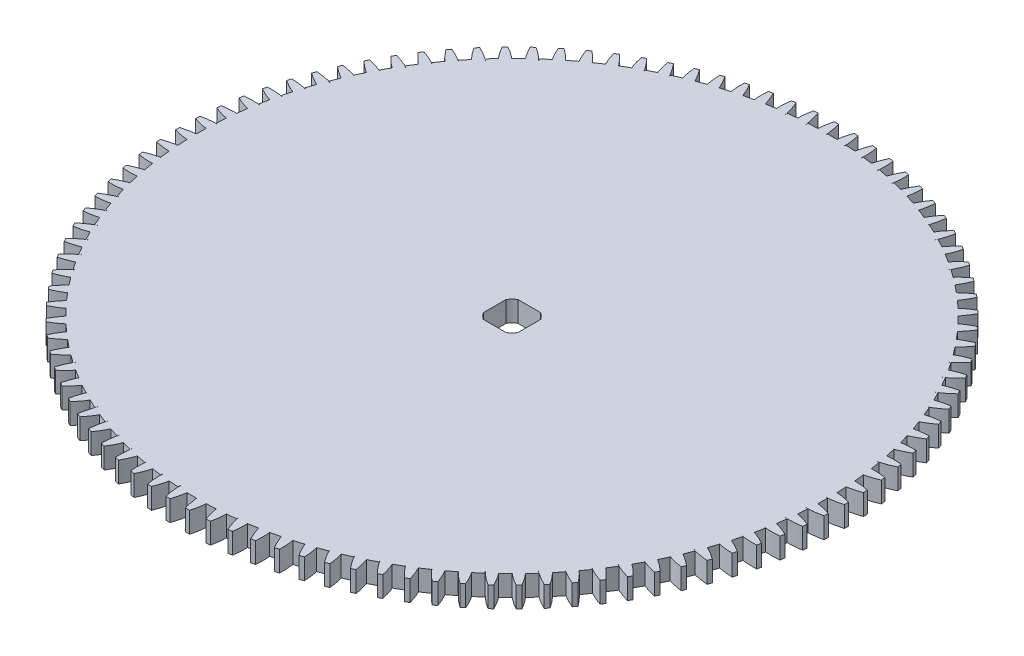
SolidWorks part; units mm, degrees
ref_plane "Front Plane" through (0, 0, 0) normal (0, 0, 1) x (1, 0, 0)
ref_plane "Top Plane" through (0, 0, 0) normal (0, 1, 0) x (1, 0, 0)
ref_plane "Right Plane" through (0, 0, 0) normal (1, 0, 0) x (0, 0, -1)
sketch "Sketch1" plane through (0, 0, 0) normal (0, 1, 0) x (1, 0, 0)
  line L0 (0, 0) -> (0, 22.6547) construction
  line L1 (0, 0) -> (-22.6547, 0) construction
  line L2 (0, 0) -> (-23.8473, -0.3602) construction
  line L3 (0, 0) -> (-22.6443, -0.6842) construction
  line L4 (0, 0) -> (-22.6133, -1.3679) construction
  circle A0 centre (0, 0) radius 23.4 construction
  circle A1 centre (0, 0) radius 22.6547 construction
  circle A2 centre (0, 0) radius 22.8375 construction
  circle A3 centre (0, 0) radius 23.85 construction
  spline S0 degree 4 poles (-22.6547, 0) (-22.7006, 0) (-22.8293, -0.0047) (-23.0718, -0.0323) (-23.4636, -0.1036) (-23.9555, -0.2325) (-24.5794, -0.4424) (-25.296, -0.7438) (-26.0604, -1.1307) (-26.8632, -1.6092) (-27.6357, -2.1365) (-28.3774, -2.7063) (-29.0885, -3.3137) (-29.9145, -4.0918) (-30.8542, -5.0873) (-31.8725, -6.3258) (-32.9282, -7.8293) (-33.8904, -9.4342) (-34.7418, -11.1002) (-35.3924, -12.6024) (-35.8843, -13.916) (-36.2511, -15.0257) (-36.5191, -15.9214) (-36.8226, -17.05) (-37.0847, -18.189) (-37.3062, -19.3369) (-37.5244, -20.7218) (-37.6528, -21.7666) (-37.7399, -22.6962) (-37.7965, -23.5145) (-37.8228, -23.9705) (-37.8493, -24.5726) (-37.8636, -25.0542) (-37.8788, -25.9206) (-37.8698, -26.557) (-37.859, -27.2471) (-37.8424, -27.5683) (-37.8349, -27.7917) knots 0 0 0 0 0 0.005377 0.015084 0.028532 0.04661 0.064855 0.092111 0.119476 0.146842 0.174209 0.201575 0.228941 0.256307 0.307035 0.361767 0.4165 0.471232 0.525964 0.580697 0.608063 0.635429 0.662795 0.690161 0.744894 0.77226 0.799626 0.854358 0.868042 0.881725 0.895408 0.909091 0.931818 0.954545 0.977273 1 1 1 1 1 construction
  spline S1 degree 4 poles (-22.6547, 0) (-22.7006, 0) (-22.8293, -0.0047) (-23.0718, -0.0323) (-23.4636, -0.1036) (-23.9555, -0.2325) (-24.5794, -0.4424) (-25.296, -0.7438) (-26.0604, -1.1307) (-26.8632, -1.6092) (-27.6357, -2.1365) (-28.3774, -2.7063) (-29.0885, -3.3137) (-29.9145, -4.0918) (-30.8542, -5.0873) (-31.8725, -6.3258) (-32.9282, -7.8293) (-33.8904, -9.4342) (-34.7418, -11.1002) (-35.3924, -12.6024) (-35.8843, -13.916) (-36.2511, -15.0257) (-36.5191, -15.9214) (-36.8226, -17.05) (-37.0847, -18.189) (-37.3062, -19.3369) (-37.5244, -20.7218) (-37.6528, -21.7666) (-37.7399, -22.6962) (-37.7965, -23.5145) (-37.8228, -23.9705) (-37.8398, -24.3581) (-37.8479, -24.5741) (-37.8515, -24.6803) knots 0 0 0 0 0 0.005377 0.015084 0.028532 0.04661 0.064855 0.092111 0.119476 0.146842 0.174209 0.201575 0.228941 0.256307 0.307035 0.361767 0.4165 0.471232 0.525964 0.580697 0.608063 0.635429 0.662795 0.690161 0.744894 0.77226 0.799626 0.854358 0.868042 0.881725 0.895408 0.909091 0.909091 0.909091 0.909091 0.909091
  dimension "D1" = 47.7
  dimension "D2" = 46.8
  dimension "D3" = 45.3093
  dimension "D4" = 45.675
  dimension "D5" = 22.6547
  dimension "D6" = 0.865
  dimension "D7" = 1.731
  dimension "D8" = 3.462
sketch "Sketch2" plane through (0, 0, 0) normal (0, 1, 0) x (1, 0, 0)
  line L0 (0, 0) -> (-23.8473, -0.3602) construction
  line L1 (0, 0) -> (-23.8473, -0.3602) construction
  line L2 (0, 0) -> (-22.6443, -0.6842) construction
  line L3 (0, 0) -> (-22.6547, 0) construction
  line L4 (0, 0) -> (-22.6133, -1.3679) construction
  line L5 (0, 0) -> (-22.6443, -0.6842) construction
  line L6 (0, 0) -> (-22.6547, 0) construction
  line L7 (0, 0) -> (-22.6133, -1.3679) construction
  line L8 (-22.8375, 0) -> (-22.8271, -0.6898) construction
  line L9 (-22.8271, -0.6898) -> (-22.7958, -1.3789)
  line L10 (-22.7958, -1.3789) -> (-22.6133, -1.3679) construction
  line L11 (-22.7958, -1.3789) -> (-1.4973, -0.0906)
  line L12 (-22.6547, 0) -> (-1.5, 0)
  circle A0 centre (0, 0) radius 22.8375 construction
  circle A1 centre (0, 0) radius 22.6547 construction
  circle A2 centre (0, 0) radius 23.4 construction
  circle A3 centre (0, 0) radius 23.85 construction
  circle A4 centre (0, 0) radius 22.8375 construction
  circle A5 centre (0, 0) radius 22.6547 construction
  circle A6 centre (0, 0) radius 23.4 construction
  circle A7 centre (0, 0) radius 23.85 construction
  arc A8 (-23.8445, -0.5105) -> (-23.8491, -0.21) centre (0, 0) cw
  circle A11 centre (0, 0) radius 1.5 construction
  arc A12 (-1.5, 0) -> (-1.4973, -0.0906) centre (0, 0) ccw
  spline S2 degree 4 poles (-22.8271, -0.6898) (-22.8338, -0.6895) (-22.9093, -0.6861) (-23.0797, -0.6705) (-23.3358, -0.6325) (-23.5823, -0.5791) (-23.7598, -0.5337) (-23.8445, -0.5105) knots 0.004428 0.004428 0.004428 0.004428 0.004428 0.005377 0.015084 0.028532 0.040915 0.040915 0.040915 0.040915 0.040915
  spline S3 degree 4 poles (-46.6257, -999.6528) (-16.7518, -30.3406) (-18.4835, -0.7117) (-21.0165, 0.3415) (-23.4636, -0.1036) (-23.9555, -0.2325) (-24.5794, -0.4424) (-25.296, -0.7438) (-26.0604, -1.1307) (-26.8632, -1.6092) (-27.6357, -2.1365) (-28.3774, -2.7063) (-29.0885, -3.3137) (-29.9145, -4.0918) (-30.8542, -5.0873) (-31.8725, -6.3258) (-32.9282, -7.8293) (-33.8904, -9.4342) (-34.7418, -11.1002) (-35.3924, -12.6024) (-35.8843, -13.916) (-36.2511, -15.0257) (-36.5191, -15.9214) (-36.8226, -17.05) (-37.0847, -18.189) (-37.3062, -19.3369) (-37.5244, -20.7218) (-37.6528, -21.7666) (-37.7399, -22.6962) (-37.7965, -23.5145) (-37.9225, -25.7) (-37.9437, -29.4409) (-36.5697, 5.0694) (-70.4762, -1023.9914) knots -0.244479 -0.244479 -0.244479 -0.244479 -0.244479 0.005377 0.015084 0.028532 0.04661 0.064855 0.092111 0.119476 0.146842 0.174209 0.201575 0.228941 0.256307 0.307035 0.361767 0.4165 0.471232 0.525964 0.580697 0.608063 0.635429 0.662795 0.690161 0.744894 0.77226 0.799626 0.854358 0.868042 0.881725 0.895408 1.116672 1.116672 1.116672 1.116672 1.116672 only from (-22.6547, 0) to (-37.8515, -24.6803) construction
  spline S4 degree 4 poles (-22.6547, 0) (-22.7006, 0) (-22.8293, -0.0047) (-23.0718, -0.0323) (-23.371, -0.0867) (-23.6221, -0.1471) (-23.791, -0.1934) (-23.8491, -0.21) knots 0 0 0 0 0 0.005377 0.015084 0.028532 0.035597 0.035597 0.035597 0.035597 0.035597
  point P18 (-22.8323, -0.3449)
  point P24 (-22.7958, -1.3789)
  dimension "D2" = 3
extrude "Boss-Extrude1" add sketch "Sketch2" along normal blind 1.5
pattern_circular "CirPattern1" count 104 over 360 of "Boss-Extrude1"
sketch "Sketch4" plane through (0, 1.5, 0) normal (0, 1, 0) x (1, 0, 0)
  line L1 (-3, 3) -> (3, 3)
  line L2 (-3, 3) -> (-3, -3)
  line L3 (-3, -3) -> (3, -3)
  line L4 (3, 3) -> (3, -3)
  line L5 (-3, 3) -> (3, -3) construction
  line L6 (-3, -3) -> (3, 3) construction
  line L7 (-0.8292, -1.25) -> (0.8292, -1.25)
  line L8 (-1.25, -0.8292) -> (-1.25, 0.8292)
  line L9 (-0.8292, 1.25) -> (0.8292, 1.25)
  line L10 (1.25, -0.8292) -> (1.25, 0.8292)
  arc A0 (-0.8292, 1.25) -> (-1.25, 0.8292) centre (0, 0) ccw
  circle A1 centre (0, 0) radius 1.5 construction
  arc A2 (1.25, 0.8292) -> (0.8292, 1.25) centre (0, 0) ccw
  arc A3 (0.8292, -1.25) -> (1.25, -0.8292) centre (0, 0) ccw
  arc A4 (-1.25, -0.8292) -> (-0.8292, -1.25) centre (0, 0) ccw
  point P0 (0, 0)
  dimension "D1" = 6
  dimension "D2" = 2.5
extrude "Boss-Extrude2" add sketch "Sketch4" against normal up to surface (1.5 mm away)
sketch "Sketch5" plane through (0, 1.5, 0) normal (0, 1, 0) x (1, 0, 0)
  circle A0 centre (0, 0) radius 5
  dimension "D1" = 10
equation "\"Module\" = .45"
equation "\"Number of Teeth\"= 104"
equation "\"Pressure Angle\"= 14.5deg"
equation "\"Pitch Diameter\"= \"Number of Teeth\" * \"Module\""
equation "\"Circular Pitch\"= pi * \"Module\""
equation "\"Addendum\"= \"Module\""
equation "\"Dedendum\"= 1.25 * \"Module\""
equation "\"Base Diameter\"= \"Pitch Diameter\" * cos ( \"Pressure Angle\" )"
equation "\"Base Radius\"= \"Base Diameter\" / 2"
equation "\"Width\"= 1.5mm"
equation "\"Outside Diameter\"= \"Pitch Diameter\" + 2 * \"Addendum\""
equation "\"D1@Sketch1\"=\"Outside Diameter\""
equation "\"D3@Sketch1\"=\"Base Diameter\""
equation "\"Root Diameter\"= \"Pitch Diameter\" - 2 * \"Dedendum\""
equation "\"D4@Sketch1\"=\"Root Diameter\""
equation "\"Tooth Angle\"= 360 / \"Number of Teeth\""
equation "\"D6@Sketch1\"=\"Tooth Angle\"/4"
equation "\"D7@Sketch1\"=\"Tooth Angle\"/2"
equation "\"D8@Sketch1\"=\"Tooth Angle\""
equation "\"D2@Sketch1\" = \"Pitch Diameter\""
equation "\"Shaft Diameter\"= 3"
equation "\"D1@CirPattern1\" = \"Number of Teeth\""
equation "\"D2@Sketch2\"  = \"Shaft Diameter\""
equation "\"D1@Boss-Extrude1\" = \"Width\""
